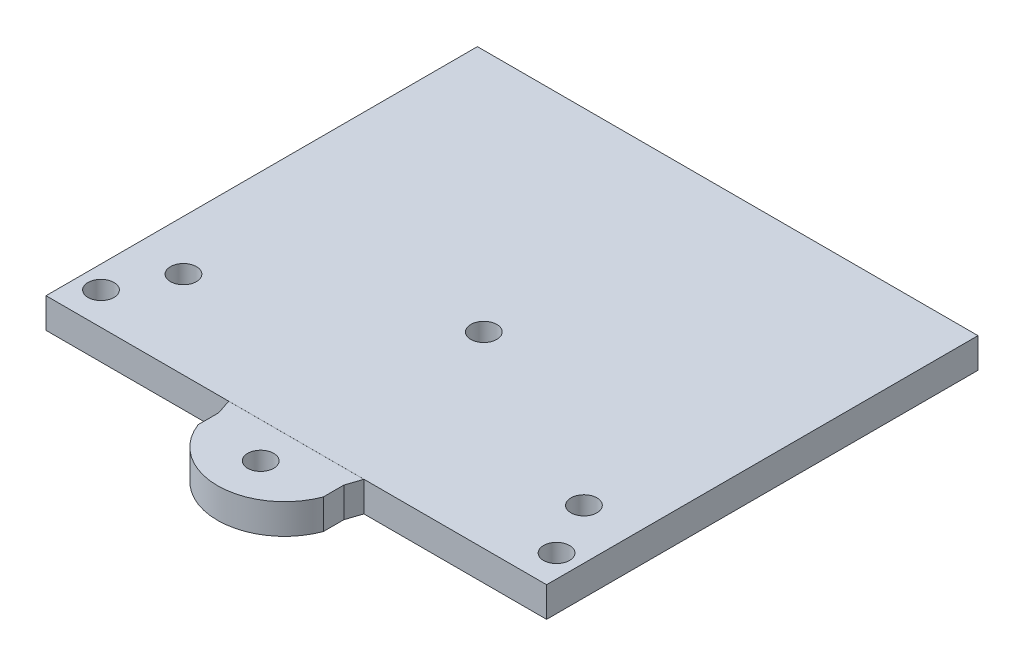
SolidWorks part; units mm, degrees
ref_plane "Front Plane" through (0, 0, 0) normal (0, 0, 1) x (1, 0, 0)
ref_plane "Top Plane" through (0, 0, 0) normal (0, 1, 0) x (1, 0, 0)
ref_plane "Right Plane" through (0, 0, 0) normal (1, 0, 0) x (0, 0, -1)
imported_body "Imported1"
sketch "Sketch1" plane through (0, 0, 0) normal (0, 1, 0) x (1, 0, 0)
  line L0 (0, 3000) -> (0, -3000)
  line L1 (-50000, -172520.0043) -> (50000, -172520.0043)
  line L2 (-50000, -172520.0043) -> (-50000, -285980.011)
  line L3 (-50000, -285980.011) -> (50000, -285980.011)
  line L4 (50000, -172520.0043) -> (50000, -285980.011)
  line L5 (0, 3000) -> (0, -3000)
extrude "Boss-Extrude2" add sketch "Sketch1" against normal blind 6000 separate body contours L1 L4 L3 L2
ref_plane "Plane2" through (0, -6010, 0) normal (0, -1, 0) x (-1, 0, 0)
sketch "Sketch4" plane through (0, -6010, 0) normal (0, -1, 0) x (-1, 0, 0)
  line L0 (12500, -288980.011) -> (13500, -285980.011)
  line L1 (14000, -284480.011) -> (12500, -288980.011) construction
  line L2 (50000, -285980.011) -> (-50000, -285980.011) construction
  line L3 (12500, -288980.011) -> (12500, -293095.0012)
  line L4 (-13500, -285980.011) -> (-12500, -288980.011)
  line L5 (-12500, -288980.011) -> (-14000, -284480.011) construction
  line L6 (-12500, -288980.011) -> (-12500, -293095.0012)
  line L7 (13500, -285980.011) -> (-13500, -285980.011)
  circle A0 centre (0.0022, -293094.9951) radius 2600.0018
  arc A1 (12500, -293095.0012) -> (-12500, -293095.0012) centre (0, -288333.9769) cw
extrude "Boss-Extrude3" add sketch "Sketch4" against normal blind 6000
sketch "Sketch7" plane through (0, -6010, 0) normal (0, -1, 0) x (-1, 0, 0)
  circle A0 centre (45499.9956, -279495.0037) radius 2600.0002
  circle A1 centre (-45499.9999, -279495.0026) radius 2599.9983
  circle A2 centre (40000.0031, -268520.0043) radius 2600.0051
  circle A3 centre (-39999.9982, -268519.9929) radius 2600.0065
  circle A4 centre (-0.0063, -248519.9966) radius 2599.9999
extrude "Cut-Extrude3" cut sketch "Sketch7" against normal blind 6500
sketch "Sketch11" plane through (0, 0, 0) normal (0, 1, 0) x (1, 0, 0)
  line L0 (50000, -172520.0043) -> (50000, -285980.011) construction
  line L1 (-50000, -172520.0043) -> (50000, -172520.0043)
  line L2 (-50000, -172520.0043) -> (-50000, -199800.0031)
  line L3 (-50000, -199800.0031) -> (50000, -199800.0031)
  line L4 (50000, -172520.0043) -> (50000, -199800.0031)
  arc A0 (44000, -193800.0031) -> (50000, -199800.0031) centre (50000, -193800.0031) ccw construction
extrude "Cut-Extrude4" cut sketch "Sketch11" against normal blind 10000
sketch "Sketch13" plane through (0, 0, 0) normal (0, 1, 0) x (1, 0, 0)
  line L1 (-50000, -172520.0043) -> (50000, -172520.0043)
  line L2 (-50000, -172520.0043) -> (-50000, -306440.0381)
  line L3 (-50000, -306440.0381) -> (50000, -306440.0381)
  line L4 (50000, -172520.0043) -> (50000, -306440.0381)
